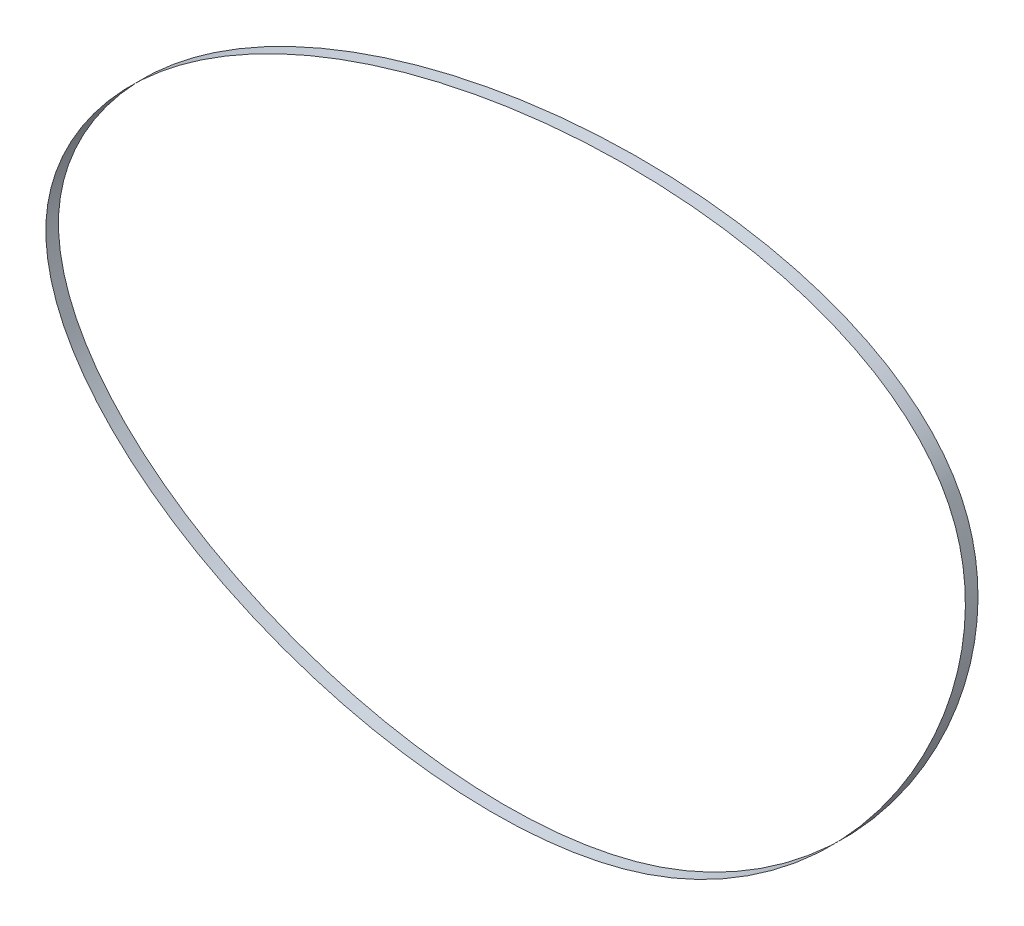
SolidWorks part; units mm, degrees
ref_plane "Ebene vorne" through (0, 0, 0) normal (0, 0, 1) x (1, 0, 0)
ref_plane "Ebene oben" through (0, 0, 0) normal (0, 1, 0) x (1, 0, 0)
ref_plane "Ebene rechts" through (0, 0, 0) normal (1, 0, 0) x (0, 0, -1)
sketch "Skizze1" plane through (0, 0, 0) normal (0, 0, 1) x (1, 0, 0)
  spline S0 degree 3 poles (-232.7406, -84.7068) (-93.7135, 118.6609) (283.5853, 128.0505) (73.2741, -224.1188) (-232.7406, -84.7068) (-93.7135, 118.6609) (283.5853, 128.0505) knots -0.642631 -0.392617 -0.09777 0 0.357369 0.607383 0.90223 1 1.357369 1.607383 1.90223 only from (-134.492, 42.8521) to (-134.492, 42.8521)
surface "Oberfläche-Linear austragen1" sketch "Skizze1" parameters "D1"=5
equation "\"LÄNGE\"=0"
equation "\"BREITE\"=0"
equation "\"HÖHE\"=0"
equation "\"DURCHMESSER\"=0"
